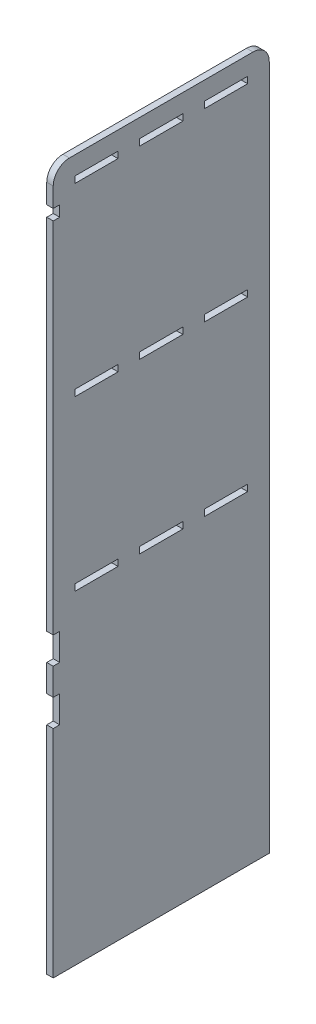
SolidWorks part; units mm, degrees
ref_plane "Alzado" through (0, 0, 0) normal (0, 0, 1) x (1, 0, 0)
ref_plane "Planta" through (0, 0, 0) normal (0, 1, 0) x (1, 0, 0)
ref_plane "Vista lateral" through (0, 0, 0) normal (1, 0, 0) x (0, 0, -1)
sketch "Croquis2" plane through (0, 0, 0) normal (1, 0, 0) x (0, 0, -1)
  line L0 (0, 650) -> (0, 588.2082) construction
  line L1 (-200, -650) -> (200, -650)
  line L2 (-200, -650) -> (-200, -250)
  line L3 (-170, 650) -> (170, 650)
  line L4 (200, -650) -> (200, 620)
  line L5 (-200, -650) -> (195.5879, 635.6607) construction
  line L6 (-200, 650) -> (200, -650) construction
  line L7 (-200, -50) -> (-40.6243, -50) construction
  line L8 (-200, -38) -> (-40.6243, -38) construction
  line L9 (-200, 262) -> (-36.9426, 262) construction
  line L10 (-200, 274) -> (-36.9426, 274) construction
  line L11 (-200, 604) -> (-36.9426, 604) construction
  line L12 (-200, 616) -> (-36.9426, 616) construction
  line L13 (-200, 646) -> (-36.9426, 646) construction
  line L14 (-40, -38) -> (40, -38)
  line L15 (-160, -50) -> (-80, -50)
  line L16 (-160, -50) -> (-160, -38)
  line L17 (-160, -38) -> (-80, -38)
  line L18 (-80, -50) -> (-80, -38)
  line L19 (40, -50) -> (40, -38)
  line L20 (-40, -50) -> (40, -50)
  line L21 (-40, -50) -> (-40, -38)
  line L22 (80, -38) -> (160, -38)
  line L23 (160, -50) -> (160, -38)
  line L24 (80, -50) -> (160, -50)
  line L25 (80, -50) -> (80, -38)
  line L26 (-160, 274) -> (-80, 274)
  line L27 (-80, 262) -> (-80, 274)
  line L28 (-160, 262) -> (-80, 262)
  line L29 (-160, 262) -> (-160, 274)
  line L30 (-40, 274) -> (40, 274)
  line L31 (40, 262) -> (40, 274)
  line L32 (-40, 262) -> (40, 262)
  line L33 (-40, 262) -> (-40, 274)
  line L34 (80, 274) -> (160, 274)
  line L35 (160, 262) -> (160, 274)
  line L36 (80, 262) -> (160, 262)
  line L37 (80, 262) -> (80, 274)
  line L38 (80, 604) -> (160, 604)
  line L39 (160, 604) -> (160, 616)
  line L40 (80, 616) -> (160, 616)
  line L41 (80, 604) -> (80, 616)
  line L42 (-40, 604) -> (40, 604)
  line L43 (40, 604) -> (40, 616)
  line L44 (-40, 616) -> (40, 616)
  line L45 (-40, 604) -> (-40, 616)
  line L46 (-160, 604) -> (-80, 604)
  line L47 (-80, 604) -> (-80, 616)
  line L48 (-160, 616) -> (-80, 616)
  line L49 (-160, 604) -> (-160, 616)
  line L50 (-200, -200) -> (-188, -200)
  line L51 (-200, -150) -> (-188, -150)
  line L53 (-200, -100) -> (-188, -100)
  line L54 (-188, -150) -> (-188, -100)
  line L55 (-188, -250) -> (-188, -200)
  line L56 (-200, -250) -> (-188, -250)
  line L58 (-200, -300) -> (200, -300) construction
  line L59 (-200, -100) -> (-200, 564)
  line L60 (-200, -200) -> (-200, -150)
  line L61 (-200, 584) -> (-200, 620)
  line L62 (-200, 564) -> (-188, 564)
  line L64 (-200, 584) -> (-188, 584)
  line L65 (-188, 564) -> (-188, 584)
  arc A0 (-200, 620) -> (-170, 650) centre (-170, 620) cw
  arc A1 (200, 620) -> (170, 650) centre (170, 620) ccw
  point P0 (0, 0)
extrude "Saliente-Extruir1" add sketch "Croquis2" along normal blind 12
equation "\"alto_total\"= 130"
equation "\"D1@Croquis2\"=\"alto_total\""
equation "\"ancho_general\"=40"
equation "\"material\"= 1.2"
equation "\"D5@Croquis2\"=\"material\""
equation "\"largo\"= 112"
equation "\"D7@Croquis2\"=\"material\""
equation "\"D9@Croquis2\"=\"material\""
equation "\"D1@Saliente-Extruir1\"=\"material\""
equation "\"ancho_joint\"= 8"
equation "\"ancho_joint_sep\"= 4"
equation "\"D12@Croquis2\"=\"ancho_joint\""
equation "\"D14@Croquis2\"=\"ancho_joint_sep\""
equation "\"D16@Croquis2\"=\"ancho_joint_sep\""
equation "\"D19@Croquis2\"=\"material\""
equation "\"alto_joint\"= 5"
equation "\"D20@Croquis2\"=\"alto_joint\""
equation "\"D21@Croquis2\"=\"alto_joint\""
equation "\"D23@Croquis2\"=\"alto_joint\""
equation "\"D24@Croquis2\"=\"alto_joint\""
equation "\"alto_joint_arriba\"= 2"
equation "\"D26@Croquis2\"=\"alto_joint_arriba\""
